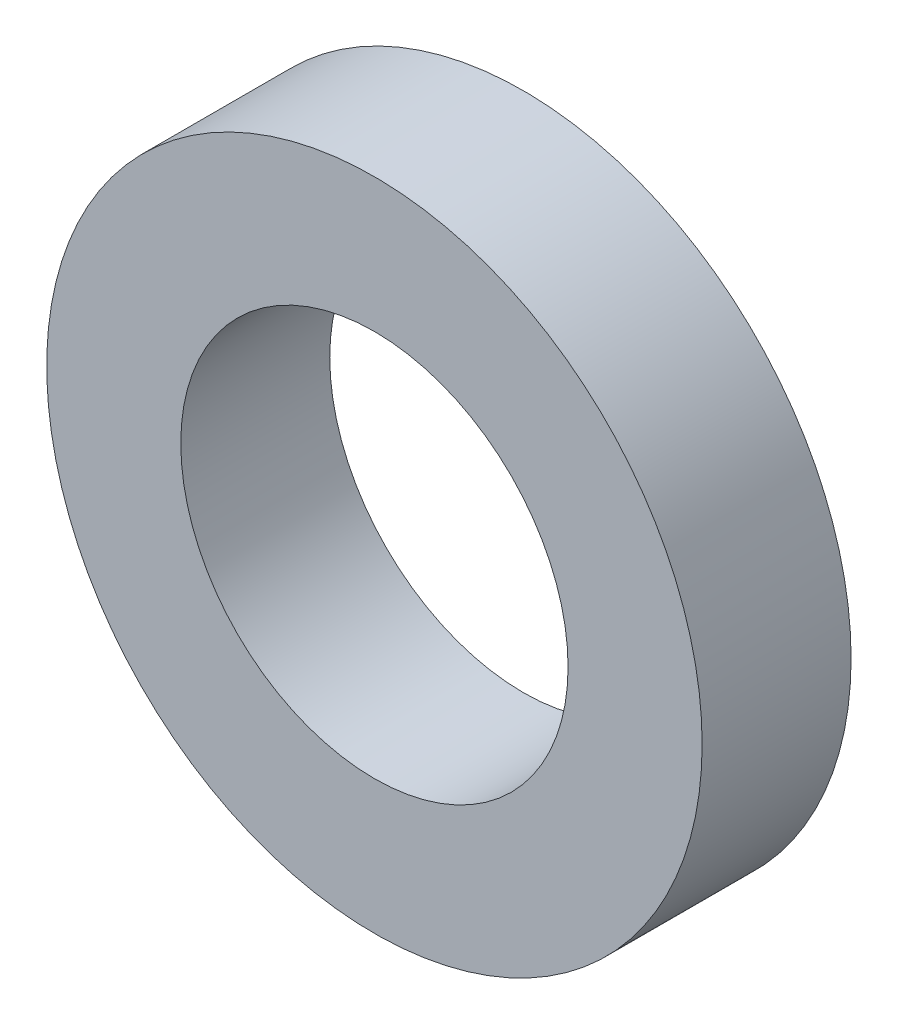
SolidWorks part; units mm, degrees
ref_plane "Plan de face" through (0, 0, 0) normal (0, 0, 1) x (1, 0, 0)
ref_plane "Plan de dessus" through (0, 0, 0) normal (0, 1, 0) x (1, 0, 0)
ref_plane "Plan de droite" through (0, 0, 0) normal (1, 0, 0) x (0, 0, -1)
sketch "Esquisse2" plane through (0, 0, 0) normal (0, 0, 1) x (1, 0, 0)
  circle A0 centre (0, 0) radius 11
  circle A1 centre (0, 0) radius 6.5
  dimension "D1" = 13
  dimension "D2" = 22
extrude "Boss.-Extru.1" add sketch "Esquisse2" along normal blind 5
